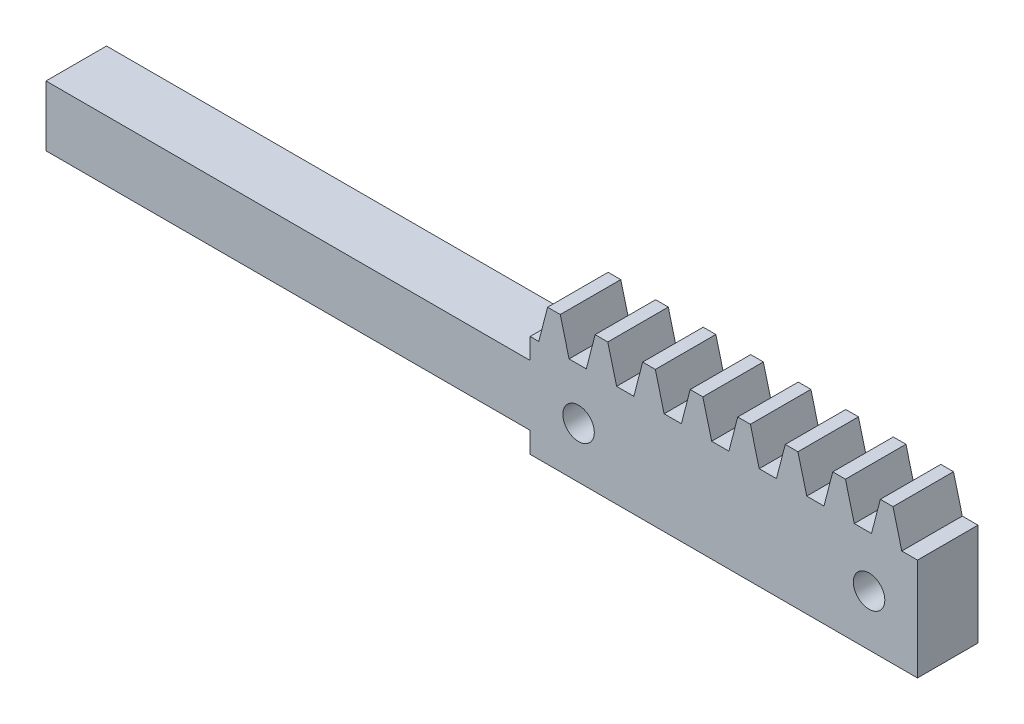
SolidWorks part; units mm, degrees
ref_plane "Plane1" through (0, 0, 0) normal (0, 0, 1) x (1, 0, 0)
ref_plane "Plane2" through (0, 0, 0) normal (0, 1, 0) x (1, 0, 0)
ref_plane "Plane3" through (0, 0, 0) normal (1, 0, 0) x (0, 0, -1)
sketch "HoldingSke" plane through (0, 0, 0) normal (0, 1, 0) x (1, 0, 0)
  line L0 (0, 0) -> (311.3205, -261.2289)
  line L1 (-15, 0) -> (100, 0) construction
  line L2 (0, 0) -> (-2.1039, 2.3779)
  line L3 (0, 0) -> (-11.863, 4.5341)
  line L4 (0, 0) -> (8.5048, 1.4996)
  line L5 (0, 0) -> (-23.7986, -8.8762)
  line L6 (0, 0) -> (-10.5278, -7.1032)
  line L9 (-67.7845, 28.3722) -> (-28.439, 38.5477)
  line L10 (-76.2, 71.12) -> (-63.5, 71.12)
  line L11 (0, 0) -> (-6.35, 0)
  line L12 (-76.2, 101.6) -> (-76.1428, 101.6)
  line L13 (24.9733, 27.94) -> (52.9518, 28.4284)
  line L14 (24.9733, 27.94) -> (24.9746, 27.94)
  line L15 (24.9733, 27.94) -> (100.4006, 29.5858)
  circle A0 centre (0, 0) radius 19.05
  circle A1 centre (0, 0) radius 6.35
  circle A2 centre (0, 0) radius 12.7
  dimension "MPH" = 12.7
  dimension "Diameter" = 38.1
  dimension "Num_teeth" = 10
  dimension "Pitch" = 406.4
  dimension "Width" = 6.35
  dimension "Show_teeth" = 400
  dimension "Thickness" = 12.7
  dimension "Ap" = 14.5
  dimension "Pitch_height" = 12.7
  dimension "Backlash" = 0.0571
  dimension "Addendum_fac" = 1
  dimension "Dedendum_fac" = 1.25
  dimension "Clearance_fac" = 0.25
  dimension "Dedendum_add" = 0.0013
  dimension "Length" = 40.64
sketch "BlankSke" plane through (0, 0, 0) normal (0, 0, 1) x (1, 0, 0)
  line L1 (0, 0) -> (40.64, 0)
  line L2 (0, 0) -> (0, 14.2875)
  line L3 (0, 14.2875) -> (40.64, 14.2875)
  line L4 (40.64, 0) -> (40.64, 14.2875)
  dimension "Length" = 40.64
  dimension "Blank_height" = 14.2875
extrude "Blank" add sketch "BlankSke" against normal blind 6.35
sketch "TooCutSkeIll" plane through (0, 0, 0) normal (0, 0, 1) x (1, 0, 0)
  line L0 (-1.8165, 14.2399) -> (-0.9823, 11.0141)
  line L1 (-0.5968, 10.7156) -> (0.5968, 10.7156)
  line L2 (0.9823, 11.0141) -> (1.8165, 14.2399)
  line L3 (40.64, 14.2875) -> (0, 14.2875) construction
  line L4 (0, 0) -> (0, 64.897) construction
  line L5 (-13.208, 12.7) -> (12.954, 12.7) construction
  line L6 (0, 0) -> (40.64, 0) construction
  line L7 (1.4183, 12.7) -> (1.4183, 48.7463) construction
  line L8 (-1.4183, 12.7) -> (-1.4183, 48.7463) construction
  line L9 (1.878, 14.2875) -> (1.878, 14.3129)
  line L10 (-1.878, 14.2875) -> (-1.878, 14.3129)
  line L11 (-1.878, 14.3129) -> (1.878, 14.3129)
  arc A0 (0.5968, 10.7156) -> (0.9823, 11.0141) centre (0.5968, 11.1138) ccw
  arc A1 (-0.9823, 11.0141) -> (-0.5968, 10.7156) centre (-0.5968, 11.1138) ccw
  arc A2 (1.878, 14.2875) -> (1.8165, 14.2399) centre (1.878, 14.224) ccw
  arc A3 (-1.8165, 14.2399) -> (-1.878, 14.2875) centre (-1.878, 14.224) ccw
  dimension "Root_fillet" = 0.3981
  dimension "Break_rad" = 0.0635
  dimension "Pitch_height" = 12.7
  dimension "Gap_width" = 2.8365
  dimension "Dedendum" = 1.9844
  dimension "Addendum_plus" = 1.6129
  dimension "Pressure_angle" = 14.5
extrude "ToothCutIll" [suppressed] cut sketch "TooCutSkeIll" against normal through all
sketch "TooCutSkeSim" plane through (0, 0, 0) normal (0, 0, 1) x (1, 0, 0)
  line L0 (0.9051, 10.7156) -> (-0.9051, 10.7156)
  line L1 (1.8354, 14.3129) -> (0.9051, 10.7156)
  line L2 (0, 17.4625) -> (0, 53.467) construction
  line L3 (1.8354, 14.3129) -> (-1.8354, 14.3129)
  line L6 (-1.8354, 14.3129) -> (-0.9051, 10.7156)
  line L9 (-1.4183, 12.7) -> (1.4183, 12.7) construction
  line L10 (0, 0) -> (40.64, 0) construction
  line L11 (1.4183, 12.7) -> (1.4183, 53.467) construction
  line L12 (-1.4183, 12.7) -> (-1.4183, 53.467) construction
  dimension "Pitch_height" = 12.7
  dimension "Pressure_angle" = 14.5
  dimension "Gap_width" = 2.8365
  dimension "Dedendum" = 1.9844
  dimension "Addendum_plus" = 1.6129
extrude "ToothCutSim" cut sketch "TooCutSkeSim" against normal through all
pattern_linear "TeethCuts" count 9 spacing 4.9873 along (1, 0, 0) of "ToothCutIll", "ToothCutSim"
sketch "Sketch1" plane through (0, 0, 0) normal (0, 0, 1) x (1, 0, 0)
  circle A0 centre (5.08, 5.3578) radius 1.651
  circle A1 centre (35.56, 5.3578) radius 1.651
  dimension "D1" = 3.302
  dimension "D2" = 3.302
extrude "Cut-Extrude1" cut sketch "Sketch1" against normal blind 9.398
sketch "Sketch2" plane through (0, 0, 0) normal (0, 0, 1) x (1, 0, 0)
  line L1 (0, 8.5328) -> (-50.8, 8.5328)
  line L2 (0, 10.7156) -> (0, 0) construction
  line L3 (-50.8, 8.5328) -> (-50.8, 2.1828)
  line L4 (-50.8, 2.1828) -> (0, 2.1828)
  line L5 (0, 2.1828) -> (0, 8.5328)
  dimension "D1" = 50.8
  dimension "D2" = 6.35
extrude "Boss-Extrude1" add sketch "Sketch2" against normal blind 6.35
scale "Scale1" scale about centroid uniform scaling yes scale factor 0.5
equation "' \"Pitch@HoldingSke\" = 4"
equation "' \"Num_teeth@HoldingSke\" = 12"
equation "' \"Ap@HoldingSke\" =  20"
equation "' \"Width@HoldingSke\" = 0.25"
equation "' \"Show_teeth@HoldingSke\" = 500"
equation "' \"Backlash@HoldingSke\" = 0.009"
equation "' \"Addendum_fac@HoldingSke\" = 1.0"
equation "' \"Dedendum_fac@HoldingSke\" = 1.25"
equation "' \"Dedendum_add@HoldingSke\" = 0.00005"
equation "' \"Clearance_fac@HoldingSke\" = 0.25"
equation "' \"Pitch_height@HoldingSke\" = 1"
equation "' \"Length@HoldingSke\" = 4.71"
equation "\"MPH@HoldingSke\" = \"Dedendum_fac@HoldingSke\" / \"Pitch@HoldingSke\" + 2 * \"Dedendum_add@HoldingSke\" + 0.002"
equation "\"MPH@HoldingSke\" = ((sgn( \"MPH@HoldingSke\" - \"Pitch_height@HoldingSke\")+1)*( \"MPH@HoldingSke\" - \"Pitch_height@HoldingSke\"))/2 + \"Pitch_height@HoldingSke\""
equation "\"Blank_height@BlankSke\" = \"Pitch_height@HoldingSke\" + \"Addendum_fac@HoldingSke\"  / \"Pitch@HoldingSke\" "
equation "\"Length@BlankSke\" =  \"Length@HoldingSke\""
equation "\"Face_width@Blank\" = \"Width@HoldingSke\""
equation "\"Pressure_angle@TooCutSkeIll\" = \"Ap@HoldingSke\""
equation "\"Addendum_plus@TooCutSkeIll\" =  \"Addendum_fac@HoldingSke\"  / \"Pitch@HoldingSke\" + 0.001"
equation "\"Dedendum@TooCutSkeIll\" = \"Dedendum_fac@HoldingSke\"  / \"Pitch@HoldingSke\""
equation "\"Pitch_height@TooCutSkeIll\" =  \"MPH@HoldingSke\""
equation "\"Gap_width@TooCutSkeIll\" = 3.14159265 / 2 / \"Pitch@HoldingSke\" + 6 * \"Backlash@HoldingSke\""
equation "\"Pressure_angle@TooCutSkeSim\" = \"Ap@HoldingSke\""
equation "\"Addendum_plus@TooCutSkeSim\" =  \"Addendum_fac@HoldingSke\"  / \"Pitch@HoldingSke\" + 0.001"
equation "\"Dedendum@TooCutSkeSim\" = \"Dedendum_fac@HoldingSke\"  / \"Pitch@HoldingSke\""
equation "\"Pitch_height@TooCutSkeSim\" =  \"MPH@HoldingSke\""
equation "\"Gap_width@TooCutSkeSim\" = 3.14159265 / 2 / \"Pitch@HoldingSke\" + 6 * \"Backlash@HoldingSke\""
equation "\"Root_fillet@TooCutSkeIll\" = \"Clearance_fac@HoldingSke\" / \"Pitch@HoldingSke\" + \"Dedendum_add@HoldingSke\""
equation "\"Break_rad@TooCutSkeIll\" = 0.02 / \"Pitch@HoldingSke\" * 2"
equation "\"Linear_pitch@TeethCuts\" = 3.14159265 / \"Pitch@HoldingSke\""
equation "\"Num_teeth@HoldingSke\" = int( ( \"Length@HoldingSke\" + 0 ) / (3.14159265 / \"Pitch@HoldingSke\")) + 0.9999  + 1"
equation " \"Num_teeth@TeethCuts\" = int( \"Show_teeth@HoldingSke\" ) + 1"
equation " \"Num_teeth@TeethCuts\" = ((sgn( \"Num_teeth@TeethCuts\" - \"Num_teeth@HoldingSke\" )-1)*( \"Num_teeth@TeethCuts\" - \"Num_teeth@HoldingSke\" ))/-2+ \"Num_teeth@HoldingSke\""
equation " \"Num_teeth@TeethCuts\" = ((sgn( \"Num_teeth@TeethCuts\" - 2.0)+1)*( \"Num_teeth@TeethCuts\" - 2.0))/2 +2.0"
